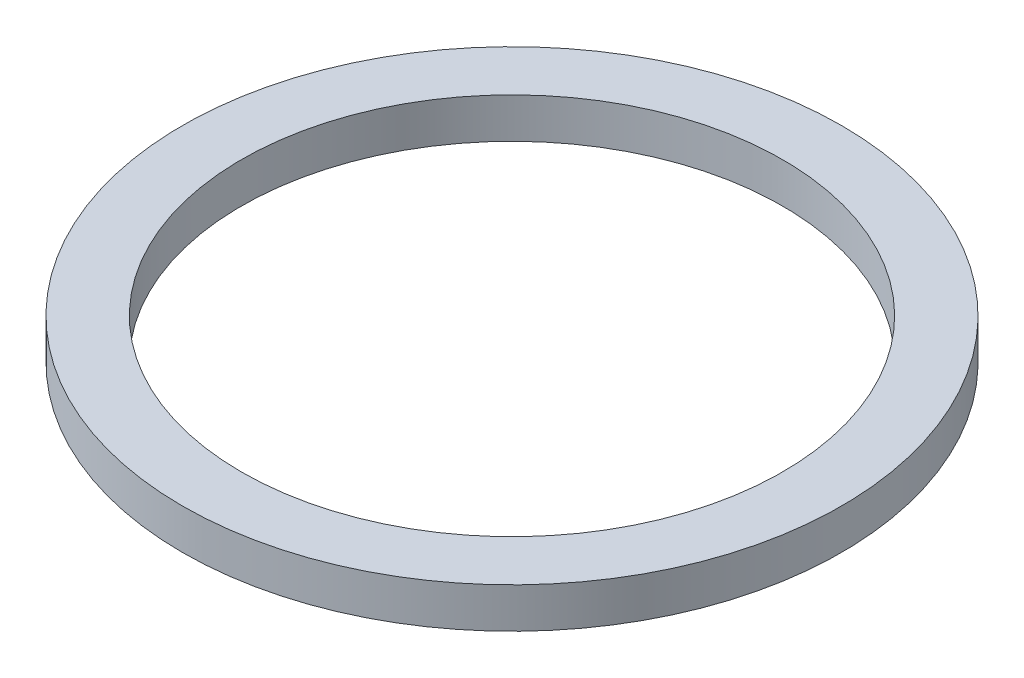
SolidWorks part; units mm, degrees
ref_plane "Front Plane" through (0, 0, 0) normal (0, 0, 1) x (1, 0, 0)
ref_plane "Top Plane" through (0, 0, 0) normal (0, 1, 0) x (1, 0, 0)
ref_plane "Right Plane" through (0, 0, 0) normal (1, 0, 0) x (0, 0, -1)
sketch "Sketch1" plane through (0, 0, 0) normal (0, 1, 0) x (1, 0, 0)
  circle A0 centre (0, 0) radius 12.065
  dimension "D1" = 24.13
extrude "Extrude1" add sketch "Sketch1" along normal blind 1.4732
sketch "Sketch2" plane through (0, 1.4732, 0) normal (0, 1, 0) x (-1, 0, 0)
  circle A0 centre (0, 0) radius 9.906
  dimension "D1" = 19.812
extrude "Cut-Extrude1" cut sketch "Sketch2" against normal through all
